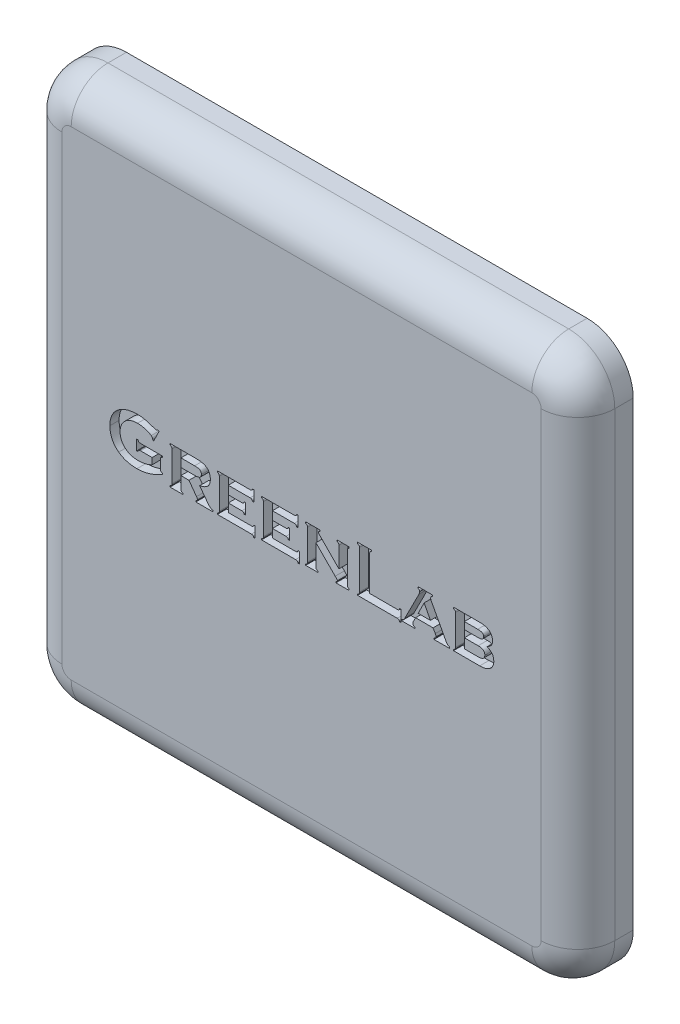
SolidWorks part; units mm, degrees
ref_plane "Front Plane" through (0, 0, 0) normal (0, 0, 1) x (1, 0, 0)
ref_plane "Top Plane" through (0, 0, 0) normal (0, 1, 0) x (1, 0, 0)
ref_plane "Right Plane" through (0, 0, 0) normal (1, 0, 0) x (0, 0, -1)
ref_plane "Plane1" through (0, 0, 3) normal (0, 0, 1) x (1, 0, 0)
sketch "Sketch1" plane through (0, 0, 3) normal (0, 0, 1) x (1, 0, 0)
  line L0 (-15, -15) -> (15, -15)
  line L1 (15, -15) -> (15, 15)
  line L2 (15, 15) -> (-15, 15)
  line L3 (-15, 15) -> (-15, -15)
extrude "Boss-Extrude1" add sketch "Sketch1" against normal blind 3
ref_plane "Plane2" through (0, 0, 1.5) normal (0, 0, 1) x (1, 0, 0)
sketch "Sketch2" plane through (0, 0, 1.5) normal (0, 0, 1) x (1, 0, 0)
  line L0 (-6.1062, -0.4167) -> (-6.5451, -0.4167)
  line L1 (-6.5451, -0.4167) -> (-6.5451, -1.0482)
  line L2 (-6.441, -1.1806) -> (-6.441, -1.25)
  line L3 (-6.441, -1.25) -> (-7.1354, -1.25)
  line L4 (-7.1354, -1.25) -> (-7.1354, -1.1806)
  line L5 (-7.0313, -1.0476) -> (-7.0313, 0.5962)
  line L6 (-7.1354, 0.7292) -> (-7.1354, 0.7986)
  line L7 (-7.1354, 0.7986) -> (-5.8051, 0.7986)
  line L8 (-5.5268, -0.382) -> (-5.1297, -0.9174)
  line L9 (-4.809, -1.1806) -> (-4.809, -1.25)
  line L10 (-4.809, -1.25) -> (-5.7341, -1.25)
  line L11 (-5.7341, -1.25) -> (-5.7341, -1.1806)
  line L12 (-5.6977, -0.9831) -> (-6.1062, -0.4167)
  spline S0 degree 3 poles (-6.5451, -1.0482) (-6.5445, -1.0606) (-6.5432, -1.0852) (-6.5328, -1.1213) (-6.5079, -1.1495) (-6.4757, -1.1679) (-6.4526, -1.1763) (-6.441, -1.1806) knots 0 0 0 0 0.202843 0.401397 0.599301 0.798427 1 1 1 1
  spline S1 degree 3 poles (-7.1354, -1.1806) (-7.1305, -1.179) (-7.1207, -1.1758) (-7.1063, -1.1704) (-7.0923, -1.1639) (-7.0789, -1.1561) (-7.0666, -1.1467) (-7.0558, -1.1355) (-7.0472, -1.1225) (-7.0406, -1.1084) (-7.036, -1.0936) (-7.0332, -1.0784) (-7.0318, -1.0631) (-7.0314, -1.0528) (-7.0313, -1.0476) knots 0 0 0 0 0.083298 0.166356 0.249358 0.332965 0.416397 0.499815 0.583579 0.667019 0.750799 0.833752 0.916711 1 1 1 1
  spline S2 degree 3 poles (-7.0313, 0.5962) (-7.0315, 0.6004) (-7.0319, 0.6086) (-7.0329, 0.6209) (-7.0345, 0.6331) (-7.037, 0.6452) (-7.0406, 0.657) (-7.0455, 0.6683) (-7.0521, 0.6788) (-7.0602, 0.6882) (-7.0693, 0.6965) (-7.0793, 0.7037) (-7.0899, 0.71) (-7.101, 0.7155) (-7.1123, 0.7205) (-7.1238, 0.725) (-7.1315, 0.7278) (-7.1354, 0.7292) knots 0 0 0 0 0.066822 0.133637 0.200355 0.266731 0.333142 0.400074 0.46641 0.533137 0.599847 0.66625 0.732989 0.799817 0.866509 0.933224 1 1 1 1
  spline S3 degree 3 poles (-5.8051, 0.7986) (-5.7806, 0.7984) (-5.7316, 0.798) (-5.6581, 0.7963) (-5.5847, 0.7928) (-5.5114, 0.7868) (-5.4385, 0.7778) (-5.3667, 0.7634) (-5.2968, 0.7426) (-5.2301, 0.7132) (-5.1882, 0.6888) (-5.1671, 0.6765) knots 0 0 0 0 0.111579 0.223149 0.334734 0.446221 0.557707 0.669006 0.779124 0.889068 1 1 1 1
  spline S4 degree 3 poles (-5.1671, 0.6765) (-5.1548, 0.6677) (-5.1301, 0.6499) (-5.0957, 0.6204) (-5.0648, 0.5874) (-5.038, 0.551) (-5.0146, 0.5123) (-4.995, 0.4716) (-4.9793, 0.4295) (-4.9671, 0.3862) (-4.9578, 0.342) (-4.952, 0.2971) (-4.949, 0.2519) (-4.9483, 0.2218) (-4.9479, 0.2067) knots 0 0 0 0 0.084133 0.167875 0.250785 0.333837 0.41762 0.500718 0.583355 0.666148 0.749546 0.833075 0.916492 1 1 1 1
  spline S5 degree 3 poles (-4.9479, 0.2067) (-4.9486, 0.1863) (-4.9499, 0.1454) (-4.9567, 0.0846) (-4.9689, 0.0246) (-4.988, -0.0335) (-5.0147, -0.0885) (-5.0482, -0.1395) (-5.0882, -0.1856) (-5.1344, -0.2256) (-5.1849, -0.2601) (-5.2384, -0.2894) (-5.294, -0.3143) (-5.3509, -0.3354) (-5.4088, -0.3532) (-5.4675, -0.3687) (-5.507, -0.3775) (-5.5268, -0.382) knots 0 0 0 0 0.067094 0.134175 0.200873 0.267649 0.334524 0.400802 0.467615 0.534397 0.600933 0.667869 0.734464 0.80076 0.867035 0.933434 1 1 1 1
  spline S6 degree 3 poles (-5.1297, -0.9174) (-5.1201, -0.93) (-5.101, -0.9552) (-5.0718, -0.9925) (-5.0415, -1.029) (-5.0099, -1.0643) (-4.9767, -1.0979) (-4.9403, -1.1284) (-4.8993, -1.1523) (-4.8551, -1.1699) (-4.8244, -1.177) (-4.809, -1.1806) knots 0 0 0 0 0.11128 0.222534 0.333807 0.445028 0.555842 0.666724 0.778367 0.888873 1 1 1 1
  spline S7 degree 3 poles (-5.6348, -1.1014) (-5.6354, -1.1071) (-5.6367, -1.1185) (-5.6441, -1.1344) (-5.6569, -1.1462) (-5.6707, -1.1563) (-5.6857, -1.1645) (-5.7014, -1.171) (-5.7176, -1.1761) (-5.7286, -1.1791) (-5.7341, -1.1806) knots 0 0 0 0 0.125931 0.250942 0.376452 0.501678 0.626963 0.751125 0.875381 1 1 1 1
  spline S8 degree 3 poles (-5.6348, -1.1014) (-5.6353, -1.0976) (-5.6364, -1.0901) (-5.6391, -1.079) (-5.6427, -1.0683) (-5.6472, -1.058) (-5.6526, -1.0481) (-5.6583, -1.0383) (-5.6642, -1.0287) (-5.6704, -1.0193) (-5.677, -1.01) (-5.6838, -1.0009) (-5.6907, -0.992) (-5.6954, -0.986) (-5.6977, -0.9831) knots 0 0 0 0 0.084083 0.167767 0.250653 0.33331 0.41632 0.499639 0.583019 0.666366 0.749761 0.833177 0.916586 1 1 1 1
extrude "Cut-Extrude1" cut sketch "Sketch2" against normal blind 0.5 from surface at 1.5
ref_plane "Plane3" through (0, 0, 4) normal (0, 0, -1) x (0, 1, 0)
sketch "Sketch3" plane through (0, 0, 4) normal (0, 0, -1) x (0, 1, 0)
  line L0 (0.4167, -5.7997) -> (0.4167, -6.5451)
  line L1 (0.4167, -6.5451) -> (-0.0347, -6.5451)
  line L2 (-0.0347, -6.5451) -> (-0.0347, -5.7997)
  spline S0 degree 3 poles (0.0011, -5.5485) (0.0061, -5.5384) (0.0161, -5.5182) (0.036, -5.4906) (0.0618, -5.4684) (0.0915, -5.452) (0.1237, -5.4415) (0.1571, -5.4355) (0.1796, -5.4345) (0.191, -5.434) knots 0 0 0 0 0.143264 0.28553 0.428089 0.571057 0.713277 0.856313 1 1 1 1
  spline S1 degree 3 poles (0.191, -5.434) (0.2146, -5.4354) (0.2615, -5.4381) (0.3289, -5.4649) (0.3755, -5.5208) (0.398, -5.5882) (0.411, -5.6578) (0.4163, -5.7286) (0.4165, -5.776) (0.4167, -5.7997) knots 0 0 0 0 0.143321 0.284976 0.426218 0.569422 0.712369 0.856024 1 1 1 1
  spline S2 degree 3 poles (-0.0347, -5.7997) (-0.0346, -5.7902) (-0.0344, -5.7713) (-0.0336, -5.743) (-0.0321, -5.7147) (-0.0298, -5.6864) (-0.0265, -5.6582) (-0.0225, -5.6301) (-0.0171, -5.6022) (-0.0088, -5.5751) (-0.0022, -5.5574) (0.0011, -5.5485) knots 0 0 0 0 0.111096 0.222237 0.333344 0.444393 0.555543 0.666816 0.777924 0.888906 1 1 1 1
extrude "Boss-Extrude2" add sketch "Sketch3" against normal blind 0.5 from surface at 1.5
sketch "Sketch4" plane through (0, 0, 1.5) normal (0, 0, 1) x (1, 0, 0)
  line L0 (9.6707, -1.25) -> (8.2465, -1.25)
  line L1 (8.2465, -1.25) -> (8.2465, -1.1806)
  line L2 (8.3507, -1.0476) -> (8.3507, 0.5962)
  line L3 (8.2465, 0.7292) -> (8.2465, 0.7986)
  line L4 (8.2465, 0.7986) -> (9.6441, 0.7986)
  spline S0 degree 3 poles (10.434, -0.6435) (10.4334, -0.6632) (10.4322, -0.7025) (10.4259, -0.7611) (10.4132, -0.8188) (10.3946, -0.8751) (10.3697, -0.929) (10.3388, -0.9798) (10.3019, -1.0266) (10.2592, -1.0684) (10.2282, -1.0933) (10.2127, -1.1057) knots 0 0 0 0 0.110911 0.221103 0.331445 0.442622 0.553891 0.664731 0.776356 0.888083 1 1 1 1
  spline S1 degree 3 poles (10.2127, -1.1057) (10.19, -1.1205) (10.1447, -1.1501) (10.0712, -1.1849) (9.994, -1.2106) (9.9148, -1.23) (9.8339, -1.242) (9.7524, -1.2484) (9.6979, -1.2495) (9.6707, -1.25) knots 0 0 0 0 0.142651 0.284291 0.426814 0.57003 0.713136 0.856495 1 1 1 1
  spline S2 degree 3 poles (8.2465, -1.1806) (8.2514, -1.179) (8.2612, -1.1758) (8.2756, -1.1704) (8.2897, -1.1639) (8.303, -1.1561) (8.3154, -1.1467) (8.3262, -1.1355) (8.3347, -1.1225) (8.3413, -1.1084) (8.3459, -1.0936) (8.3487, -1.0784) (8.3502, -1.0631) (8.3505, -1.0528) (8.3507, -1.0476) knots 0 0 0 0 0.083298 0.166356 0.249358 0.332965 0.416397 0.499815 0.583579 0.667019 0.750799 0.833752 0.916711 1 1 1 1
  spline S3 degree 3 poles (8.3507, 0.5962) (8.35, 0.6085) (8.3486, 0.6328) (8.3389, 0.6689) (8.3142, 0.6976) (8.2817, 0.7162) (8.2583, 0.7248) (8.2465, 0.7292) knots 0 0 0 0 0.19988 0.396352 0.595026 0.796125 1 1 1 1
  spline S4 degree 3 poles (9.6441, 0.7986) (9.6711, 0.7981) (9.725, 0.797) (9.8058, 0.7916) (9.886, 0.7817) (9.9654, 0.7657) (10.0423, 0.7412) (10.1163, 0.7086) (10.1606, 0.6782) (10.1828, 0.663) knots 0 0 0 0 0.143296 0.286494 0.429412 0.572337 0.715374 0.857377 1 1 1 1
  spline S5 degree 3 poles (10.1828, 0.663) (10.1956, 0.6522) (10.221, 0.6306) (10.256, 0.5946) (10.2858, 0.5545) (10.3111, 0.5116) (10.3318, 0.4662) (10.3468, 0.4187) (10.3567, 0.3701) (10.3627, 0.3209) (10.364, 0.2878) (10.3646, 0.2713) knots 0 0 0 0 0.111824 0.223636 0.335033 0.445743 0.557092 0.668348 0.778631 0.888987 1 1 1 1
  spline S6 degree 3 poles (10.3646, 0.2713) (10.3635, 0.2454) (10.3615, 0.1936) (10.3448, 0.1174) (10.3128, 0.046) (10.2639, -0.015) (10.2054, -0.0664) (10.1411, -0.1104) (10.0963, -0.1366) (10.0738, -0.1497) knots 0 0 0 0 0.14285 0.285587 0.427748 0.570824 0.713189 0.856262 1 1 1 1
  spline S7 degree 3 poles (10.0738, -0.1497) (10.0826, -0.1539) (10.1003, -0.1623) (10.1266, -0.1752) (10.1526, -0.1886) (10.1783, -0.2027) (10.2035, -0.2177) (10.228, -0.2339) (10.2517, -0.2512) (10.2747, -0.2694) (10.2894, -0.2822) (10.2968, -0.2886) knots 0 0 0 0 0.111096 0.222157 0.333196 0.444276 0.555455 0.666551 0.777717 0.888848 1 1 1 1
  spline S8 degree 3 poles (10.2968, -0.2886) (10.3068, -0.2991) (10.3269, -0.32) (10.354, -0.3542) (10.3765, -0.3916) (10.3956, -0.4307) (10.4103, -0.4714) (10.421, -0.5135) (10.4282, -0.5564) (10.4325, -0.5998) (10.4335, -0.6289) (10.434, -0.6435) knots 0 0 0 0 0.111354 0.222267 0.333845 0.444932 0.555115 0.66552 0.776882 0.888419 1 1 1 1
extrude "Cut-Extrude2" cut sketch "Sketch4" against normal blind 0.5 from surface at 1.5
sketch "Sketch5" plane through (0, 0, 4) normal (0, 0, -1) x (0, 1, 0)
  line L0 (-0.3472, 9.5855) -> (-0.3472, 8.8368)
  line L1 (-0.3472, 8.8368) -> (-0.8681, 8.8368)
  line L2 (-0.8681, 8.8368) -> (-0.8681, 9.5855)
  spline S0 degree 3 poles (-0.8681, 9.5855) (-0.8672, 9.6098) (-0.8654, 9.6584) (-0.8563, 9.7305) (-0.8365, 9.8005) (-0.8019, 9.865) (-0.7481, 9.9155) (-0.6798, 9.9432) (-0.6318, 9.9463) (-0.6076, 9.9479) knots 0 0 0 0 0.144145 0.28764 0.429843 0.573148 0.71584 0.857433 1 1 1 1
  spline S1 degree 3 poles (-0.6076, 9.9479) (-0.5922, 9.9474) (-0.5613, 9.9463) (-0.5159, 9.9359) (-0.4735, 9.9164) (-0.4367, 9.8877) (-0.4069, 9.852) (-0.3845, 9.8114) (-0.3689, 9.7678) (-0.3582, 9.7229) (-0.3512, 9.6774) (-0.3482, 9.6315) (-0.3475, 9.6009) (-0.3472, 9.5855) knots 0 0 0 0 0.091139 0.182256 0.273529 0.364502 0.455746 0.546554 0.637473 0.72849 0.818807 0.909235 1 1 1 1
extrude "Boss-Extrude3" add sketch "Sketch5" against normal blind 0.5 from surface at 1.5
sketch "Sketch6" plane through (0, 0, 4) normal (0, 0, -1) x (0, 1, 0)
  line L0 (0.4167, 9.5638) -> (0.4167, 8.8368)
  line L1 (0.4167, 8.8368) -> (0.0347, 8.8368)
  line L2 (0.0347, 8.8368) -> (0.0347, 9.5638)
  spline S0 degree 3 poles (0.0347, 9.5638) (0.035, 9.5841) (0.0356, 9.6246) (0.0397, 9.6852) (0.0507, 9.7448) (0.071, 9.802) (0.11, 9.8502) (0.167, 9.8745) (0.2068, 9.8772) (0.2268, 9.8785) knots 0 0 0 0 0.14428 0.288327 0.43111 0.574241 0.716997 0.858003 1 1 1 1
  spline S1 degree 3 poles (0.2268, 9.8785) (0.247, 9.8772) (0.287, 9.8746) (0.3437, 9.8493) (0.3811, 9.8003) (0.4008, 9.7434) (0.4115, 9.6842) (0.4157, 9.6241) (0.4163, 9.5839) (0.4167, 9.5638) knots 0 0 0 0 0.144139 0.28548 0.427397 0.570467 0.712918 0.856313 1 1 1 1
extrude "Boss-Extrude4" add sketch "Sketch6" against normal blind 0.5 from surface at 1.5
sketch "Sketch7" plane through (0, 0, 1.5) normal (0, 0, 1) x (1, 0, 0)
  line L0 (7.2586, -0.9343) -> (7.1398, -0.7292)
  line L1 (7.1398, -0.7292) -> (6.1898, -0.7292)
  line L2 (6.1898, -0.7292) -> (6.0764, -0.9478)
  line L3 (6.1632, -1.1806) -> (6.1632, -1.25)
  line L4 (6.1632, -1.25) -> (5.434, -1.25)
  line L5 (5.434, -1.25) -> (5.434, -1.1806)
  line L6 (5.6185, -1.0189) -> (6.3726, 0.4671)
  line L7 (6.3118, 0.7292) -> (6.3118, 0.7986)
  line L8 (6.3118, 0.7986) -> (7.1094, 0.7986)
  line L9 (7.1094, 0.7986) -> (7.1094, 0.7292)
  line L10 (7.054, 0.4617) -> (7.8266, -0.9793)
  line L11 (8.0382, -1.1806) -> (8.0382, -1.25)
  line L12 (8.0382, -1.25) -> (7.1875, -1.25)
  line L13 (7.1875, -1.25) -> (7.1875, -1.1806)
  spline S0 degree 3 poles (6.0764, -0.9478) (6.0743, -0.9522) (6.0702, -0.961) (6.0642, -0.9742) (6.0585, -0.9876) (6.0533, -1.0011) (6.0485, -1.0148) (6.0445, -1.0287) (6.0413, -1.0428) (6.039, -1.0571) (6.0382, -1.0667) (6.0379, -1.0715) knots 0 0 0 0 0.111433 0.222859 0.334257 0.445662 0.556665 0.667537 0.778533 0.889404 1 1 1 1
  spline S1 degree 3 poles (6.0379, -1.0715) (6.0386, -1.0802) (6.0399, -1.0975) (6.0498, -1.1221) (6.0677, -1.1412) (6.0885, -1.1567) (6.1124, -1.1674) (6.1375, -1.1749) (6.1546, -1.1787) (6.1632, -1.1806) knots 0 0 0 0 0.143336 0.284493 0.426758 0.568772 0.710871 0.855236 1 1 1 1
  spline S2 degree 3 poles (5.434, -1.1806) (5.451, -1.1771) (5.4846, -1.1704) (5.5323, -1.1483) (5.567, -1.109) (5.5944, -1.065) (5.6104, -1.0343) (5.6185, -1.0189) knots 0 0 0 0 0.200924 0.398079 0.597331 0.798284 1 1 1 1
  spline S3 degree 3 poles (6.3726, 0.4671) (6.377, 0.4765) (6.3858, 0.4951) (6.3978, 0.5237) (6.4072, 0.5531) (6.4126, 0.5835) (6.4142, 0.6039) (6.4149, 0.6141) knots 0 0 0 0 0.200818 0.401427 0.601706 0.800608 1 1 1 1
  spline S4 degree 3 poles (6.4149, 0.6141) (6.4144, 0.6187) (6.4134, 0.6278) (6.411, 0.6412) (6.4067, 0.6543) (6.4001, 0.6663) (6.3919, 0.6774) (6.3824, 0.6873) (6.372, 0.6962) (6.3607, 0.7041) (6.349, 0.7112) (6.3368, 0.7176) (6.3244, 0.7235) (6.316, 0.7273) (6.3118, 0.7292) knots 0 0 0 0 0.083294 0.166584 0.24922 0.332436 0.416065 0.49928 0.582425 0.66585 0.74926 0.832694 0.916342 1 1 1 1
  spline S5 degree 3 poles (7.1094, 0.7292) (7.1051, 0.7273) (7.0964, 0.7235) (7.0836, 0.7175) (7.0712, 0.7107) (7.0594, 0.703) (7.0484, 0.6941) (7.0384, 0.6842) (7.0294, 0.6733) (7.0217, 0.6614) (7.0156, 0.6487) (7.0118, 0.6351) (7.0097, 0.6211) (7.0089, 0.6118) (7.0085, 0.6071) knots 0 0 0 0 0.083654 0.167321 0.250841 0.333978 0.417297 0.500544 0.583634 0.667176 0.750413 0.833266 0.916622 1 1 1 1
  spline S6 degree 3 poles (7.0085, 0.6071) (7.0088, 0.6014) (7.0094, 0.59) (7.0113, 0.573) (7.0152, 0.5563) (7.0202, 0.54) (7.0257, 0.5238) (7.032, 0.5079) (7.0389, 0.4923) (7.0463, 0.4769) (7.0514, 0.4668) (7.054, 0.4617) knots 0 0 0 0 0.111191 0.222244 0.333391 0.444742 0.555871 0.666815 0.777866 0.888975 1 1 1 1
  spline S7 degree 3 poles (7.8266, -0.9793) (7.8337, -0.9921) (7.8479, -1.0176) (7.8698, -1.0556) (7.8938, -1.0922) (7.9203, -1.127) (7.9549, -1.1545) (7.9957, -1.1707) (8.024, -1.1773) (8.0382, -1.1806) knots 0 0 0 0 0.143479 0.286928 0.429931 0.572815 0.715088 0.856991 1 1 1 1
  spline S8 degree 3 poles (7.1875, -1.1806) (7.1958, -1.1789) (7.2123, -1.1756) (7.2365, -1.1681) (7.2593, -1.1571) (7.2792, -1.1415) (7.2947, -1.1212) (7.3031, -1.0969) (7.3042, -1.08) (7.3047, -1.0715) knots 0 0 0 0 0.143672 0.286774 0.428416 0.570748 0.712946 0.856052 1 1 1 1
  spline S9 degree 3 poles (7.3047, -1.0715) (7.3044, -1.0661) (7.3037, -1.0553) (7.3017, -1.0391) (7.2978, -1.0233) (7.2928, -1.0078) (7.2871, -0.9926) (7.2807, -0.9777) (7.2737, -0.963) (7.2663, -0.9486) (7.2611, -0.939) (7.2586, -0.9343) knots 0 0 0 0 0.111178 0.222213 0.333308 0.444614 0.555734 0.666711 0.777789 0.88893 1 1 1 1
extrude "Cut-Extrude3" cut sketch "Sketch7" against normal blind 0.5 from surface at 1.5
sketch "Sketch8" plane through (0, 0, 2.5) normal (0, 0, 1) x (1, 0, 0)
  line L0 (6.3292, -0.4514) -> (6.6558, 0.204)
  line L1 (6.6558, 0.204) -> (6.9944, -0.4514)
  line L2 (6.9944, -0.4514) -> (6.3292, -0.4514)
extrude "Boss-Extrude5" add sketch "Sketch8" along normal blind 0.5
sketch "Sketch9" plane through (0, 0, 1.5) normal (0, 0, 1) x (1, 0, 0)
  line L0 (-8.1076, -0.6896) -> (-8.1076, -0.3472)
  line L1 (-8.1076, -0.3472) -> (-8.737, -0.3472)
  line L2 (-8.8715, -0.4514) -> (-8.941, -0.4514)
  line L3 (-8.941, -0.4514) -> (-8.941, 0.1042)
  line L4 (-8.941, 0.1042) -> (-8.8715, 0.1042)
  line L5 (-8.7397, 0) -> (-7.5521, 0)
  line L6 (-7.5521, 0) -> (-7.5521, -0.0695)
  line L7 (-7.6563, -0.1942) -> (-7.6563, -0.6738)
  line L8 (-7.7951, 1.1041) -> (-7.7257, 1.0764)
  line L9 (-7.7257, 1.0764) -> (-8.0208, 0.4774)
  line L10 (-8.0208, 0.4774) -> (-8.074, 0.5056)
  spline S0 degree 3 poles (-8.737, -0.3472) (-8.7411, -0.3474) (-8.7495, -0.3478) (-8.762, -0.3488) (-8.7744, -0.3503) (-8.7866, -0.3526) (-8.7986, -0.356) (-8.8102, -0.3608) (-8.821, -0.3671) (-8.8306, -0.3751) (-8.8392, -0.3842) (-8.8465, -0.3943) (-8.8529, -0.4051) (-8.8584, -0.4163) (-8.8632, -0.4278) (-8.8675, -0.4395) (-8.8702, -0.4474) (-8.8715, -0.4514) knots 0 0 0 0 0.06684 0.133664 0.200492 0.266971 0.333322 0.400216 0.4667 0.53323 0.600077 0.666419 0.733002 0.799858 0.866542 0.933237 1 1 1 1
  spline S1 degree 3 poles (-8.8715, 0.1042) (-8.8703, 0.1002) (-8.8677, 0.0924) (-8.8636, 0.0807) (-8.859, 0.0692) (-8.8538, 0.058) (-8.8478, 0.0473) (-8.8407, 0.0371) (-8.8324, 0.0279) (-8.8229, 0.0198) (-8.8123, 0.0135) (-8.8008, 0.0087) (-8.7889, 0.0053) (-8.7767, 0.003) (-8.7644, 0.0015) (-8.7521, 0.0006) (-8.7438, 0.0002) (-8.7397, 0) knots 0 0 0 0 0.066768 0.133536 0.200149 0.266511 0.332886 0.39977 0.466306 0.532831 0.599818 0.666326 0.733287 0.800031 0.866615 0.933257 1 1 1 1
  spline S2 degree 3 poles (-7.5521, -0.0695) (-7.5559, -0.0707) (-7.5634, -0.0731) (-7.5746, -0.0771) (-7.5856, -0.0815) (-7.5964, -0.0865) (-7.6067, -0.0923) (-7.6166, -0.0989) (-7.6257, -0.1066) (-7.6339, -0.1153) (-7.6406, -0.1252) (-7.6459, -0.1359) (-7.6498, -0.1472) (-7.6526, -0.1588) (-7.6545, -0.1705) (-7.6557, -0.1823) (-7.6561, -0.1903) (-7.6563, -0.1942) knots 0 0 0 0 0.066745 0.133459 0.199946 0.266259 0.332646 0.399532 0.466171 0.532717 0.5998 0.666339 0.733244 0.800089 0.866628 0.93321 1 1 1 1
  spline S3 degree 3 poles (-7.6563, -0.6738) (-7.656, -0.6797) (-7.6555, -0.6913) (-7.6536, -0.7087) (-7.6496, -0.7257) (-7.6429, -0.742) (-7.6329, -0.7564) (-7.6199, -0.7682) (-7.605, -0.7775) (-7.5894, -0.7854) (-7.5732, -0.7919) (-7.5565, -0.7973) (-7.5398, -0.8024) (-7.5231, -0.8076) (-7.5063, -0.8128) (-7.4896, -0.8179) (-7.4784, -0.8214) (-7.4729, -0.8231) knots 0 0 0 0 0.066615 0.1331 0.199888 0.266384 0.333005 0.399459 0.466086 0.532501 0.599246 0.666044 0.732835 0.799626 0.866418 0.933209 1 1 1 1
  spline S4 degree 3 poles (-7.4729, -0.8231) (-7.5226, -0.8515) (-7.622, -0.9083) (-7.773, -0.9901) (-7.9287, -1.0626) (-8.0882, -1.127) (-8.2513, -1.1821) (-8.418, -1.2267) (-8.5872, -1.2596) (-8.7584, -1.2807) (-8.8732, -1.2834) (-8.9307, -1.2847) knots 0 0 0 0 0.111028 0.221892 0.332642 0.443598 0.554954 0.666167 0.777542 0.888727 1 1 1 1
  spline S5 degree 3 poles (-8.9307, -1.2847) (-8.9695, -1.284) (-9.0471, -1.2825) (-9.1633, -1.2747) (-9.2786, -1.2592) (-9.3925, -1.2373) (-9.5044, -1.2073) (-9.6141, -1.1696) (-9.7207, -1.1227) (-9.8223, -1.0651) (-9.8865, -1.0213) (-9.9186, -0.9994) knots 0 0 0 0 0.111321 0.222583 0.333916 0.44465 0.555043 0.66564 0.777095 0.888501 1 1 1 1
  spline S6 degree 3 poles (-9.9186, -0.9994) (-9.9522, -0.9723) (-10.0192, -0.9183) (-10.1108, -0.827) (-10.1905, -0.7257) (-10.2577, -0.616) (-10.312, -0.4995) (-10.3531, -0.3781) (-10.3808, -0.2534) (-10.3961, -0.1267) (-10.3982, -0.0416) (-10.3993, 0.0011) knots 0 0 0 0 0.111932 0.223833 0.335372 0.446128 0.557576 0.66878 0.77885 0.888998 1 1 1 1
  spline S7 degree 3 poles (-10.3993, 0.0011) (-10.3984, 0.0311) (-10.3967, 0.0911) (-10.3898, 0.1807) (-10.3767, 0.2695) (-10.3567, 0.3571) (-10.3307, 0.4432) (-10.2981, 0.5269) (-10.2587, 0.6074) (-10.2129, 0.6844) (-10.1611, 0.7579) (-10.1027, 0.8265) (-10.039, 0.8901) (-9.9942, 0.93) (-9.9718, 0.95) knots 0 0 0 0 0.083685 0.167041 0.250103 0.333282 0.416969 0.500291 0.583124 0.666026 0.749532 0.833097 0.916472 1 1 1 1
  spline S8 degree 3 poles (-9.9718, 0.95) (-9.9464, 0.9699) (-9.8959, 1.0095) (-9.8159, 1.0626) (-9.7321, 1.1082) (-9.6458, 1.1485) (-9.5569, 1.1833) (-9.4655, 1.2124) (-9.3722, 1.2359) (-9.2777, 1.2544) (-9.1825, 1.2685) (-9.0867, 1.2777) (-8.9905, 1.2826) (-8.9264, 1.284) (-8.8943, 1.2847) knots 0 0 0 0 0.084018 0.167232 0.249842 0.332365 0.415152 0.498539 0.582143 0.665642 0.749252 0.832858 0.916408 1 1 1 1
  spline S9 degree 3 poles (-8.8943, 1.2847) (-8.8626, 1.2841) (-8.7994, 1.2828) (-8.7046, 1.2775) (-8.6103, 1.2666) (-8.5166, 1.2509) (-8.4237, 1.2301) (-8.3317, 1.205) (-8.2408, 1.1763) (-8.1508, 1.1451) (-8.0913, 1.1228) (-8.0615, 1.1116) knots 0 0 0 0 0.111023 0.221816 0.332506 0.443407 0.554706 0.665983 0.777318 0.888655 1 1 1 1
  spline S10 degree 3 poles (-8.0615, 1.1116) (-8.0552, 1.1092) (-8.0424, 1.1042) (-8.0233, 1.0969) (-8.004, 1.0899) (-7.9846, 1.0832) (-7.9651, 1.0772) (-7.9453, 1.0718) (-7.9253, 1.0673) (-7.9051, 1.0638) (-7.8915, 1.0624) (-7.8847, 1.0617) knots 0 0 0 0 0.111113 0.222213 0.3333 0.44441 0.555576 0.666683 0.777848 0.888899 1 1 1 1
  spline S11 degree 3 poles (-7.7951, 1.1041) (-7.7985, 1.1015) (-7.8051, 1.0963) (-7.8152, 1.0888) (-7.8258, 1.0818) (-7.8367, 1.0756) (-7.848, 1.0699) (-7.8599, 1.0659) (-7.8721, 1.0631) (-7.8805, 1.0622) (-7.8847, 1.0617) knots 0 0 0 0 0.125374 0.250747 0.37602 0.501268 0.626156 0.750017 0.874503 1 1 1 1
  spline S12 degree 3 poles (-8.074, 0.5056) (-8.0742, 0.5108) (-8.0746, 0.5211) (-8.0758, 0.5365) (-8.0781, 0.5518) (-8.081, 0.5669) (-8.0849, 0.5819) (-8.0914, 0.596) (-8.1002, 0.6087) (-8.1102, 0.6205) (-8.1213, 0.6313) (-8.1329, 0.6415) (-8.1449, 0.6512) (-8.153, 0.6576) (-8.157, 0.6608) knots 0 0 0 0 0.083588 0.167162 0.250399 0.333468 0.416701 0.500407 0.583278 0.666596 0.750048 0.833326 0.916644 1 1 1 1
  spline S13 degree 3 poles (-8.157, 0.6608) (-8.1813, 0.6767) (-8.2295, 0.7084) (-8.3069, 0.7471) (-8.3877, 0.7772) (-8.4701, 0.8032) (-8.5539, 0.8255) (-8.6388, 0.8436) (-8.7244, 0.8576) (-8.8109, 0.8654) (-8.8687, 0.8672) (-8.8976, 0.868) knots 0 0 0 0 0.111591 0.222065 0.332465 0.44334 0.554724 0.666049 0.777458 0.888706 1 1 1 1
  spline S14 degree 3 poles (-8.8976, 0.868) (-8.9237, 0.8675) (-8.9759, 0.8663) (-9.0541, 0.86) (-9.1314, 0.8474) (-9.2075, 0.8296) (-9.2818, 0.806) (-9.3537, 0.7761) (-9.4232, 0.7403) (-9.489, 0.6974) (-9.5302, 0.6651) (-9.5508, 0.6489) knots 0 0 0 0 0.111421 0.222691 0.334079 0.445107 0.555443 0.665776 0.776893 0.888346 1 1 1 1
  spline S15 degree 3 poles (-9.5508, 0.6489) (-9.5713, 0.6301) (-9.6124, 0.5926) (-9.6683, 0.531) (-9.7162, 0.4635) (-9.7575, 0.3917) (-9.7906, 0.3158) (-9.8149, 0.237) (-9.8322, 0.1569) (-9.8412, 0.0752) (-9.8429, 0.0204) (-9.8438, -0.0071) knots 0 0 0 0 0.112436 0.22439 0.335258 0.446302 0.558218 0.668796 0.7787 0.888912 1 1 1 1
  spline S16 degree 3 poles (-9.8438, -0.0071) (-9.8429, -0.0339) (-9.8412, -0.0873) (-9.8323, -0.1672) (-9.8152, -0.2458) (-9.7909, -0.3224) (-9.7585, -0.3959) (-9.7185, -0.4656) (-9.6716, -0.531) (-9.6173, -0.5908) (-9.5777, -0.627) (-9.5578, -0.6451) knots 0 0 0 0 0.111227 0.22195 0.332879 0.444491 0.555146 0.665712 0.777228 0.888548 1 1 1 1
  spline S17 degree 3 poles (-9.5578, -0.6451) (-9.5362, -0.662) (-9.4929, -0.6959) (-9.4235, -0.7408) (-9.3496, -0.777) (-9.2733, -0.8071) (-9.1951, -0.8307) (-9.115, -0.8478) (-9.0335, -0.8592) (-8.9513, -0.866) (-8.8963, -0.8674) (-8.8688, -0.8681) knots 0 0 0 0 0.11152 0.22294 0.334443 0.444884 0.554993 0.665497 0.77689 0.888426 1 1 1 1
  spline S18 degree 3 poles (-8.8688, -0.8681) (-8.8396, -0.8674) (-8.7812, -0.8659) (-8.6937, -0.8604) (-8.6068, -0.8495) (-8.5204, -0.8344) (-8.4346, -0.8155) (-8.3499, -0.7921) (-8.2665, -0.7643) (-8.1857, -0.7297) (-8.1337, -0.7029) (-8.1076, -0.6896) knots 0 0 0 0 0.111138 0.222031 0.332835 0.443848 0.55517 0.666401 0.777727 0.888832 1 1 1 1
extrude "Cut-Extrude4" cut sketch "Sketch9" against normal blind 0.5 from surface at 1.5
sketch "Sketch10" plane through (0, 0, 1.5) normal (0, 0, 1) x (1, 0, 0)
  line L0 (-3.2384, -0.4167) -> (-3.9757, -0.4167)
  line L1 (-3.9757, -0.4167) -> (-3.9757, -0.8681)
  line L2 (-3.9757, -0.8681) -> (-2.7176, -0.8681)
  line L3 (-2.5868, -0.7639) -> (-2.5174, -0.7639)
  line L4 (-2.5174, -0.7639) -> (-2.5174, -1.3542)
  line L5 (-2.5174, -1.3542) -> (-2.5868, -1.3542)
  line L6 (-2.7181, -1.25) -> (-4.566, -1.25)
  line L7 (-4.566, -1.25) -> (-4.566, -1.1806)
  line L8 (-4.4618, -1.0476) -> (-4.4618, 0.5962)
  line L9 (-4.566, 0.7292) -> (-4.566, 0.7986)
  line L10 (-4.566, 0.7986) -> (-2.7881, 0.7986)
  line L11 (-2.6563, 0.9028) -> (-2.5868, 0.9028)
  line L12 (-2.5868, 0.9028) -> (-2.5868, 0.3125)
  line L13 (-2.5868, 0.3125) -> (-2.6563, 0.3125)
  line L14 (-2.7875, 0.4167) -> (-3.9757, 0.4167)
  line L15 (-3.9757, 0.4167) -> (-3.9757, -0.0347)
  line L16 (-3.9757, -0.0347) -> (-3.2384, -0.0347)
  line L17 (-3.1076, 0.0694) -> (-3.0382, 0.0694)
  line L18 (-3.0382, 0.0694) -> (-3.0382, -0.5208)
  line L19 (-3.0382, -0.5208) -> (-3.1076, -0.5208)
  spline S0 degree 3 poles (-2.7176, -0.8681) (-2.7135, -0.8679) (-2.7053, -0.8675) (-2.693, -0.8667) (-2.6808, -0.8652) (-2.6688, -0.8627) (-2.6571, -0.859) (-2.6459, -0.8539) (-2.6355, -0.8473) (-2.6261, -0.8393) (-2.6179, -0.8302) (-2.6109, -0.8201) (-2.6048, -0.8095) (-2.5996, -0.7984) (-2.5949, -0.7871) (-2.5907, -0.7755) (-2.5881, -0.7678) (-2.5868, -0.7639) knots 0 0 0 0 0.06692 0.133824 0.200705 0.267151 0.333553 0.400527 0.46695 0.533596 0.600372 0.666656 0.733215 0.800005 0.866643 0.933295 1 1 1 1
  spline S1 degree 3 poles (-2.5868, -1.3542) (-2.588, -1.3502) (-2.5904, -1.3424) (-2.5944, -1.3308) (-2.5991, -1.3195) (-2.6044, -1.3085) (-2.6107, -1.2979) (-2.618, -1.288) (-2.6265, -1.279) (-2.636, -1.2712) (-2.6466, -1.2649) (-2.6578, -1.2599) (-2.6695, -1.2561) (-2.6815, -1.2535) (-2.6936, -1.2517) (-2.7058, -1.2506) (-2.714, -1.2502) (-2.7181, -1.25) knots 0 0 0 0 0.066852 0.133538 0.199979 0.266367 0.333101 0.400035 0.466513 0.533481 0.600205 0.666733 0.733749 0.800364 0.866787 0.933296 1 1 1 1
  spline S2 degree 3 poles (-4.566, -1.1806) (-4.5611, -1.179) (-4.5513, -1.1758) (-4.5369, -1.1704) (-4.5228, -1.1639) (-4.5095, -1.1561) (-4.4971, -1.1467) (-4.4863, -1.1355) (-4.4778, -1.1225) (-4.4712, -1.1084) (-4.4666, -1.0936) (-4.4638, -1.0784) (-4.4623, -1.0631) (-4.462, -1.0528) (-4.4618, -1.0476) knots 0 0 0 0 0.083298 0.166356 0.249358 0.332965 0.416397 0.499815 0.583579 0.667019 0.750799 0.833752 0.916711 1 1 1 1
  spline S3 degree 3 poles (-4.4618, 0.5962) (-4.462, 0.6004) (-4.4625, 0.6086) (-4.4635, 0.6209) (-4.4651, 0.6331) (-4.4676, 0.6452) (-4.4711, 0.657) (-4.4761, 0.6683) (-4.4826, 0.6788) (-4.4907, 0.6882) (-4.4999, 0.6965) (-4.5099, 0.7037) (-4.5205, 0.71) (-4.5315, 0.7155) (-4.5429, 0.7205) (-4.5544, 0.725) (-4.5621, 0.7278) (-4.566, 0.7292) knots 0 0 0 0 0.066822 0.133637 0.200355 0.266731 0.333142 0.400074 0.46641 0.533137 0.599847 0.66625 0.732989 0.799817 0.866509 0.933224 1 1 1 1
  spline S4 degree 3 poles (-2.7881, 0.7986) (-2.784, 0.7988) (-2.7757, 0.7991) (-2.7634, 0.8001) (-2.7512, 0.8017) (-2.7392, 0.8042) (-2.7274, 0.8079) (-2.7161, 0.8129) (-2.7055, 0.8191) (-2.6959, 0.827) (-2.6875, 0.8361) (-2.6804, 0.8462) (-2.6742, 0.8569) (-2.6687, 0.868) (-2.664, 0.8794) (-2.6599, 0.891) (-2.6575, 0.8988) (-2.6563, 0.9028) knots 0 0 0 0 0.066826 0.133593 0.20005 0.266367 0.333041 0.399837 0.466103 0.533022 0.599786 0.666425 0.733429 0.800105 0.86663 0.933231 1 1 1 1
  spline S5 degree 3 poles (-2.6563, 0.3125) (-2.6578, 0.3174) (-2.6609, 0.3271) (-2.6662, 0.3415) (-2.6724, 0.3555) (-2.6799, 0.369) (-2.6891, 0.3814) (-2.7002, 0.3923) (-2.7129, 0.4011) (-2.7268, 0.4079) (-2.7416, 0.4125) (-2.7569, 0.4149) (-2.7722, 0.416) (-2.7824, 0.4164) (-2.7875, 0.4167) knots 0 0 0 0 0.083194 0.166138 0.248954 0.332208 0.415957 0.499181 0.5831 0.666464 0.750374 0.833541 0.916692 1 1 1 1
  spline S6 degree 3 poles (-3.2384, -0.0347) (-3.2261, -0.034) (-3.2018, -0.0324) (-3.1663, -0.0216) (-3.1381, 0.0027) (-3.1201, 0.0348) (-3.1118, 0.0578) (-3.1076, 0.0694) knots 0 0 0 0 0.202313 0.400629 0.597889 0.797306 1 1 1 1
  spline S7 degree 3 poles (-3.1076, -0.5208) (-3.1089, -0.5169) (-3.1114, -0.5092) (-3.1156, -0.4977) (-3.1203, -0.4864) (-3.1257, -0.4754) (-3.1319, -0.4648) (-3.1389, -0.4548) (-3.1471, -0.4456) (-3.1564, -0.4376) (-3.1668, -0.4311) (-3.178, -0.426) (-3.1897, -0.4223) (-3.2018, -0.4197) (-3.2139, -0.418) (-3.2261, -0.4171) (-3.2343, -0.4168) (-3.2384, -0.4167) knots 0 0 0 0 0.066787 0.133555 0.200074 0.266395 0.332793 0.399689 0.466217 0.532675 0.599716 0.666252 0.733154 0.800013 0.866594 0.933228 1 1 1 1
extrude "Cut-Extrude5" cut sketch "Sketch10" against normal blind 0.5 from surface at 1.5
sketch "Sketch11" plane through (0, 0, 1.5) normal (0, 0, 1) x (1, 0, 0)
  line L0 (-0.8426, -0.4167) -> (-1.5799, -0.4167)
  line L1 (-1.5799, -0.4167) -> (-1.5799, -0.8681)
  line L2 (-1.5799, -0.8681) -> (-0.3217, -0.8681)
  line L3 (-0.191, -0.7639) -> (-0.1215, -0.7639)
  line L4 (-0.1215, -0.7639) -> (-0.1215, -1.3542)
  line L5 (-0.1215, -1.3542) -> (-0.191, -1.3542)
  line L6 (-0.3223, -1.25) -> (-2.1701, -1.25)
  line L7 (-2.1701, -1.25) -> (-2.1701, -1.1806)
  line L8 (-2.066, -1.0476) -> (-2.066, 0.5962)
  line L9 (-2.1701, 0.7292) -> (-2.1701, 0.7986)
  line L10 (-2.1701, 0.7986) -> (-0.3923, 0.7986)
  line L11 (-0.2604, 0.9028) -> (-0.191, 0.9028)
  line L12 (-0.191, 0.9028) -> (-0.191, 0.3125)
  line L13 (-0.191, 0.3125) -> (-0.2604, 0.3125)
  line L14 (-0.3917, 0.4167) -> (-1.5799, 0.4167)
  line L15 (-1.5799, 0.4167) -> (-1.5799, -0.0347)
  line L16 (-1.5799, -0.0347) -> (-0.8426, -0.0347)
  line L17 (-0.7118, 0.0694) -> (-0.6424, 0.0694)
  line L18 (-0.6424, 0.0694) -> (-0.6424, -0.5208)
  line L19 (-0.6424, -0.5208) -> (-0.7118, -0.5208)
  spline S0 degree 3 poles (-0.3217, -0.8681) (-0.3176, -0.8679) (-0.3094, -0.8675) (-0.2971, -0.8667) (-0.2849, -0.8652) (-0.2729, -0.8627) (-0.2612, -0.859) (-0.2501, -0.8539) (-0.2397, -0.8473) (-0.2303, -0.8393) (-0.2221, -0.8302) (-0.2151, -0.8201) (-0.209, -0.8095) (-0.2037, -0.7984) (-0.1991, -0.7871) (-0.1949, -0.7755) (-0.1923, -0.7678) (-0.191, -0.7639) knots 0 0 0 0 0.06692 0.133824 0.200705 0.267151 0.333553 0.400527 0.46695 0.533596 0.600372 0.666656 0.733215 0.800005 0.866643 0.933295 1 1 1 1
  spline S1 degree 3 poles (-0.191, -1.3542) (-0.1922, -1.3502) (-0.1945, -1.3424) (-0.1986, -1.3308) (-0.2032, -1.3195) (-0.2086, -1.3085) (-0.2149, -1.2979) (-0.2222, -1.288) (-0.2307, -1.279) (-0.2402, -1.2712) (-0.2507, -1.2649) (-0.262, -1.2599) (-0.2737, -1.2561) (-0.2857, -1.2535) (-0.2978, -1.2517) (-0.31, -1.2506) (-0.3182, -1.2502) (-0.3223, -1.25) knots 0 0 0 0 0.066852 0.133538 0.199979 0.266367 0.333101 0.400035 0.466513 0.533481 0.600205 0.666733 0.733749 0.800364 0.866787 0.933296 1 1 1 1
  spline S2 degree 3 poles (-2.1701, -1.1806) (-2.1652, -1.179) (-2.1555, -1.1758) (-2.141, -1.1704) (-2.127, -1.1639) (-2.1137, -1.1561) (-2.1013, -1.1467) (-2.0905, -1.1355) (-2.0819, -1.1225) (-2.0754, -1.1084) (-2.0708, -1.0936) (-2.0679, -1.0784) (-2.0665, -1.0631) (-2.0662, -1.0528) (-2.066, -1.0476) knots 0 0 0 0 0.083298 0.166356 0.249358 0.332965 0.416397 0.499815 0.583579 0.667019 0.750799 0.833752 0.916711 1 1 1 1
  spline S3 degree 3 poles (-2.066, 0.5962) (-2.0662, 0.6004) (-2.0666, 0.6086) (-2.0677, 0.6209) (-2.0693, 0.6331) (-2.0717, 0.6452) (-2.0753, 0.657) (-2.0803, 0.6683) (-2.0868, 0.6788) (-2.0949, 0.6882) (-2.104, 0.6965) (-2.114, 0.7037) (-2.1247, 0.71) (-2.1357, 0.7155) (-2.147, 0.7205) (-2.1585, 0.725) (-2.1663, 0.7278) (-2.1701, 0.7292) knots 0 0 0 0 0.066822 0.133637 0.200355 0.266731 0.333142 0.400074 0.46641 0.533137 0.599847 0.66625 0.732989 0.799817 0.866509 0.933224 1 1 1 1
  spline S4 degree 3 poles (-0.3923, 0.7986) (-0.3881, 0.7988) (-0.3799, 0.7991) (-0.3676, 0.8001) (-0.3554, 0.8017) (-0.3434, 0.8042) (-0.3316, 0.8079) (-0.3203, 0.8129) (-0.3096, 0.8191) (-0.3001, 0.827) (-0.2917, 0.8361) (-0.2846, 0.8462) (-0.2783, 0.8569) (-0.2729, 0.868) (-0.2682, 0.8794) (-0.264, 0.891) (-0.2616, 0.8988) (-0.2604, 0.9028) knots 0 0 0 0 0.066826 0.133593 0.20005 0.266367 0.333041 0.399837 0.466103 0.533022 0.599786 0.666425 0.733429 0.800105 0.86663 0.933231 1 1 1 1
  spline S5 degree 3 poles (-0.2604, 0.3125) (-0.262, 0.3174) (-0.2651, 0.3271) (-0.2704, 0.3415) (-0.2766, 0.3555) (-0.2841, 0.369) (-0.2933, 0.3814) (-0.3043, 0.3923) (-0.3171, 0.4011) (-0.331, 0.4079) (-0.3458, 0.4125) (-0.361, 0.4149) (-0.3764, 0.416) (-0.3866, 0.4164) (-0.3917, 0.4167) knots 0 0 0 0 0.083194 0.166138 0.248954 0.332208 0.415957 0.499181 0.5831 0.666464 0.750374 0.833541 0.916692 1 1 1 1
  spline S6 degree 3 poles (-0.8426, -0.0347) (-0.8303, -0.034) (-0.8059, -0.0324) (-0.7705, -0.0216) (-0.7422, 0.0027) (-0.7243, 0.0348) (-0.716, 0.0578) (-0.7118, 0.0694) knots 0 0 0 0 0.202313 0.400629 0.597889 0.797306 1 1 1 1
  spline S7 degree 3 poles (-0.7118, -0.5208) (-0.7131, -0.5169) (-0.7156, -0.5092) (-0.7198, -0.4977) (-0.7245, -0.4864) (-0.7299, -0.4754) (-0.736, -0.4648) (-0.7431, -0.4548) (-0.7512, -0.4456) (-0.7606, -0.4376) (-0.771, -0.4311) (-0.7822, -0.426) (-0.7939, -0.4223) (-0.8059, -0.4197) (-0.8181, -0.418) (-0.8303, -0.4171) (-0.8385, -0.4168) (-0.8426, -0.4167) knots 0 0 0 0 0.066787 0.133555 0.200074 0.266395 0.332793 0.399689 0.466217 0.532675 0.599716 0.666252 0.733154 0.800013 0.866594 0.933228 1 1 1 1
extrude "Cut-Extrude6" cut sketch "Sketch11" against normal blind 0.5 from surface at 1.5
sketch "Sketch12" plane through (0, 0, 1.5) normal (0, 0, 1) x (1, 0, 0)
  line L0 (1.8273, -0.9581) -> (0.7812, 0.0939)
  line L1 (0.7812, 0.0939) -> (0.7812, -1.046)
  line L2 (0.8854, -1.1806) -> (0.8854, -1.25)
  line L3 (0.8854, -1.25) -> (0.2257, -1.25)
  line L4 (0.2257, -1.25) -> (0.2257, -1.1806)
  line L5 (0.3299, -1.0476) -> (0.3299, 0.5962)
  line L6 (0.2257, 0.7292) -> (0.2257, 0.7986)
  line L7 (0.2257, 0.7986) -> (0.9966, 0.7986)
  line L8 (0.9966, 0.7986) -> (0.9966, 0.7292)
  line L9 (0.9749, 0.5588) -> (2.0312, -0.5111)
  line L10 (2.0312, -0.5111) -> (2.0312, 0.5962)
  line L11 (1.9271, 0.7292) -> (1.9271, 0.7986)
  line L12 (1.9271, 0.7986) -> (2.5868, 0.7986)
  line L13 (2.5868, 0.7986) -> (2.5868, 0.7292)
  line L14 (2.4826, 0.5962) -> (2.4826, -1.046)
  line L15 (2.5868, -1.1806) -> (2.5868, -1.25)
  line L16 (2.5868, -1.25) -> (1.8685, -1.25)
  line L17 (1.8685, -1.25) -> (1.8685, -1.1806)
  spline S0 degree 3 poles (0.7812, -1.046) (0.7814, -1.0502) (0.7817, -1.0584) (0.7828, -1.0708) (0.7845, -1.0831) (0.787, -1.0953) (0.7906, -1.1072) (0.7956, -1.1186) (0.802, -1.1293) (0.8099, -1.1389) (0.819, -1.1475) (0.829, -1.1549) (0.8396, -1.1613) (0.8506, -1.1671) (0.862, -1.1721) (0.8736, -1.1766) (0.8815, -1.1792) (0.8854, -1.1806) knots 0 0 0 0 0.066636 0.133411 0.200074 0.266553 0.3331 0.399935 0.466512 0.533159 0.600034 0.666595 0.73308 0.799749 0.866539 0.933259 1 1 1 1
  spline S1 degree 3 poles (0.2257, -1.1806) (0.2306, -1.179) (0.2404, -1.1758) (0.2548, -1.1704) (0.2688, -1.1639) (0.2822, -1.1561) (0.2945, -1.1467) (0.3053, -1.1355) (0.3139, -1.1225) (0.3205, -1.1084) (0.3251, -1.0936) (0.3279, -1.0784) (0.3293, -1.0631) (0.3297, -1.0528) (0.3299, -1.0476) knots 0 0 0 0 0.083298 0.166356 0.249358 0.332965 0.416397 0.499815 0.583579 0.667019 0.750799 0.833752 0.916711 1 1 1 1
  spline S2 degree 3 poles (0.3299, 0.5962) (0.3296, 0.6004) (0.3292, 0.6086) (0.3282, 0.6209) (0.3266, 0.6331) (0.3241, 0.6452) (0.3205, 0.657) (0.3156, 0.6683) (0.3091, 0.6788) (0.301, 0.6882) (0.2918, 0.6965) (0.2818, 0.7037) (0.2712, 0.71) (0.2601, 0.7155) (0.2488, 0.7205) (0.2373, 0.725) (0.2296, 0.7278) (0.2257, 0.7292) knots 0 0 0 0 0.066822 0.133637 0.200355 0.266731 0.333142 0.400074 0.46641 0.533137 0.599847 0.66625 0.732989 0.799817 0.866509 0.933224 1 1 1 1
  spline S3 degree 3 poles (0.9174, 0.6592) (0.9179, 0.6639) (0.9189, 0.6734) (0.9237, 0.6872) (0.9329, 0.6984) (0.944, 0.7076) (0.9563, 0.7149) (0.9694, 0.7206) (0.9829, 0.7251) (0.9921, 0.7278) (0.9966, 0.7292) knots 0 0 0 0 0.125359 0.250663 0.375722 0.50052 0.625853 0.750577 0.875161 1 1 1 1
  spline S4 degree 3 poles (0.9174, 0.6592) (0.9179, 0.6559) (0.9187, 0.6493) (0.9208, 0.6397) (0.9235, 0.6302) (0.9272, 0.6211) (0.932, 0.6125) (0.9371, 0.6041) (0.9426, 0.596) (0.9486, 0.5881) (0.9549, 0.5805) (0.9614, 0.5732) (0.9681, 0.5659) (0.9727, 0.5612) (0.9749, 0.5588) knots 0 0 0 0 0.083869 0.167735 0.250909 0.33347 0.41625 0.499535 0.582919 0.666233 0.749646 0.833103 0.916546 1 1 1 1
  spline S5 degree 3 poles (2.0312, 0.5962) (2.0311, 0.6004) (2.0307, 0.6086) (2.03, 0.621) (2.0286, 0.6333) (2.0261, 0.6454) (2.0223, 0.6572) (2.0172, 0.6684) (2.0107, 0.6789) (2.0028, 0.6885) (1.9937, 0.6969) (1.9837, 0.7042) (1.973, 0.7105) (1.9619, 0.716) (1.9504, 0.7208) (1.9388, 0.7251) (1.931, 0.7278) (1.9271, 0.7292) knots 0 0 0 0 0.066829 0.133647 0.200171 0.266445 0.33311 0.399815 0.46591 0.532499 0.599391 0.665846 0.732622 0.799562 0.866339 0.933137 1 1 1 1
  spline S6 degree 3 poles (2.5868, 0.7292) (2.5829, 0.7278) (2.5751, 0.7252) (2.5635, 0.7209) (2.5521, 0.7161) (2.5411, 0.7107) (2.5304, 0.7044) (2.5204, 0.6971) (2.5113, 0.6887) (2.5034, 0.6792) (2.497, 0.6686) (2.4921, 0.6572) (2.4884, 0.6453) (2.4859, 0.6332) (2.4842, 0.6209) (2.4832, 0.6086) (2.4828, 0.6004) (2.4826, 0.5962) knots 0 0 0 0 0.066763 0.133507 0.200028 0.266362 0.332796 0.399735 0.466198 0.532716 0.599725 0.666225 0.733106 0.799946 0.866558 0.933211 1 1 1 1
  spline S7 degree 3 poles (2.4826, -1.046) (2.4828, -1.0502) (2.4832, -1.0585) (2.4842, -1.0708) (2.4858, -1.0831) (2.4884, -1.0953) (2.4922, -1.1072) (2.4971, -1.1186) (2.5034, -1.1295) (2.5113, -1.1391) (2.5206, -1.1474) (2.5308, -1.1544) (2.5414, -1.1607) (2.5524, -1.1665) (2.5636, -1.1717) (2.5751, -1.1764) (2.5829, -1.1792) (2.5868, -1.1806) knots 0 0 0 0 0.066915 0.133655 0.200173 0.266712 0.333794 0.400644 0.467297 0.534592 0.600905 0.667 0.733436 0.80016 0.866749 0.933324 1 1 1 1
  spline S8 degree 3 poles (1.9472, -1.1149) (1.9467, -1.1195) (1.9457, -1.1288) (1.9409, -1.1422) (1.9318, -1.1531) (1.9207, -1.1617) (1.9083, -1.1682) (1.8953, -1.1731) (1.882, -1.1771) (1.873, -1.1794) (1.8685, -1.1806) knots 0 0 0 0 0.125067 0.250357 0.375381 0.500272 0.625706 0.750434 0.875099 1 1 1 1
  spline S9 degree 3 poles (1.9472, -1.1149) (1.9465, -1.1105) (1.9453, -1.1017) (1.9419, -1.0887) (1.9356, -1.0768) (1.9279, -1.0658) (1.9194, -1.0555) (1.9105, -1.0455) (1.9015, -1.0355) (1.8925, -1.0256) (1.8833, -1.0158) (1.8741, -1.0061) (1.8649, -0.9964) (1.8555, -0.9867) (1.8461, -0.9772) (1.8367, -0.9676) (1.8304, -0.9613) (1.8273, -0.9581) knots 0 0 0 0 0.066941 0.133019 0.199063 0.265964 0.332654 0.399362 0.466086 0.532827 0.599564 0.666301 0.73304 0.799781 0.86652 0.93326 1 1 1 1
extrude "Cut-Extrude7" cut sketch "Sketch12" against normal blind 0.5 from surface at 1.5
sketch "Sketch13" plane through (0, 0, 1.5) normal (0, 0, 1) x (1, 0, 0)
  line L0 (3.6979, 1.0476) -> (3.6979, -0.8333)
  line L1 (3.6979, -0.8333) -> (5.1991, -0.8333)
  line L2 (5.3299, -0.7292) -> (5.3993, -0.7292)
  line L3 (5.3993, -0.7292) -> (5.3993, -1.3542)
  line L4 (5.3993, -1.3542) -> (5.3299, -1.3542)
  line L5 (5.1986, -1.25) -> (3.0382, -1.25)
  line L6 (3.0382, -1.25) -> (3.0382, -1.1806)
  line L7 (3.1424, -1.0482) -> (3.1424, 1.0482)
  line L8 (3.0382, 1.1805) -> (3.0382, 1.25)
  line L9 (3.0382, 1.25) -> (3.8021, 1.25)
  line L10 (3.8021, 1.25) -> (3.8021, 1.1805)
  spline S0 degree 3 poles (5.1991, -0.8333) (5.2115, -0.8326) (5.236, -0.8313) (5.2719, -0.821) (5.3003, -0.7965) (5.3179, -0.764) (5.3259, -0.7408) (5.3299, -0.7292) knots 0 0 0 0 0.203007 0.401837 0.599231 0.798105 1 1 1 1
  spline S1 degree 3 poles (5.3299, -1.3542) (5.3285, -1.3503) (5.3259, -1.3425) (5.3216, -1.331) (5.3169, -1.3196) (5.3116, -1.3086) (5.3055, -1.2979) (5.2984, -1.2878) (5.2902, -1.2786) (5.2809, -1.2706) (5.2704, -1.2641) (5.2592, -1.2589) (5.2475, -1.255) (5.2354, -1.2526) (5.2231, -1.2512) (5.2109, -1.2505) (5.2027, -1.2502) (5.1986, -1.25) knots 0 0 0 0 0.066765 0.13353 0.200128 0.266495 0.332874 0.399752 0.466311 0.532695 0.599741 0.666306 0.733102 0.800031 0.866632 0.933288 1 1 1 1
  spline S2 degree 3 poles (3.0382, -1.1806) (3.0421, -1.1792) (3.0499, -1.1766) (3.0615, -1.1723) (3.0729, -1.1676) (3.084, -1.1623) (3.0947, -1.1561) (3.1048, -1.149) (3.114, -1.1407) (3.122, -1.1312) (3.1284, -1.1206) (3.1332, -1.1091) (3.1367, -1.0973) (3.1391, -1.0851) (3.1407, -1.0729) (3.1418, -1.0605) (3.1422, -1.0523) (3.1424, -1.0482) knots 0 0 0 0 0.066737 0.13347 0.200021 0.26636 0.332744 0.399632 0.466135 0.532629 0.599647 0.666177 0.733122 0.799926 0.866544 0.933214 1 1 1 1
  spline S3 degree 3 poles (3.1424, 1.0482) (3.1422, 1.0523) (3.1418, 1.0605) (3.1411, 1.0729) (3.1397, 1.0852) (3.1373, 1.0973) (3.1334, 1.109) (3.1283, 1.1202) (3.1218, 1.1308) (3.114, 1.1403) (3.1049, 1.1488) (3.0949, 1.156) (3.0842, 1.1622) (3.073, 1.1676) (3.0615, 1.1723) (3.0499, 1.1766) (3.0421, 1.1792) (3.0382, 1.1805) knots 0 0 0 0 0.066853 0.133706 0.200321 0.26658 0.333097 0.399904 0.46604 0.532498 0.599445 0.665887 0.732597 0.799543 0.866334 0.93314 1 1 1 1
  spline S4 degree 3 poles (3.8021, 1.1805) (3.7902, 1.1767) (3.7668, 1.169) (3.7339, 1.1509) (3.7099, 1.1215) (3.6999, 1.085) (3.6986, 1.0602) (3.6979, 1.0476) knots 0 0 0 0 0.201456 0.39976 0.597796 0.797013 1 1 1 1
extrude "Cut-Extrude8" cut sketch "Sketch13" against normal blind 0.5 from surface at 1.5
fillet "Fillet1" radius 2.5 4 edges at (15, -15, 1.5) (-15, -15, 1.5) (15, 15, 1.5) (-15, 15, 1.5)
chamfer "Chamfer1" distance 0.0911 angle 60.421 1 edges at (-7.4729, -0.8231, 2.75)
fillet "Fillet2" radius 2 8 edges at (0, 15, 3) (-14.2678, 14.2678, 3) (14.2678, 14.2678, 3) (-15, 0, 3) (15, 0, 3) (-14.2678, -14.2678, 3) (14.2678, -14.2678, 3) (0, -15, 3)
